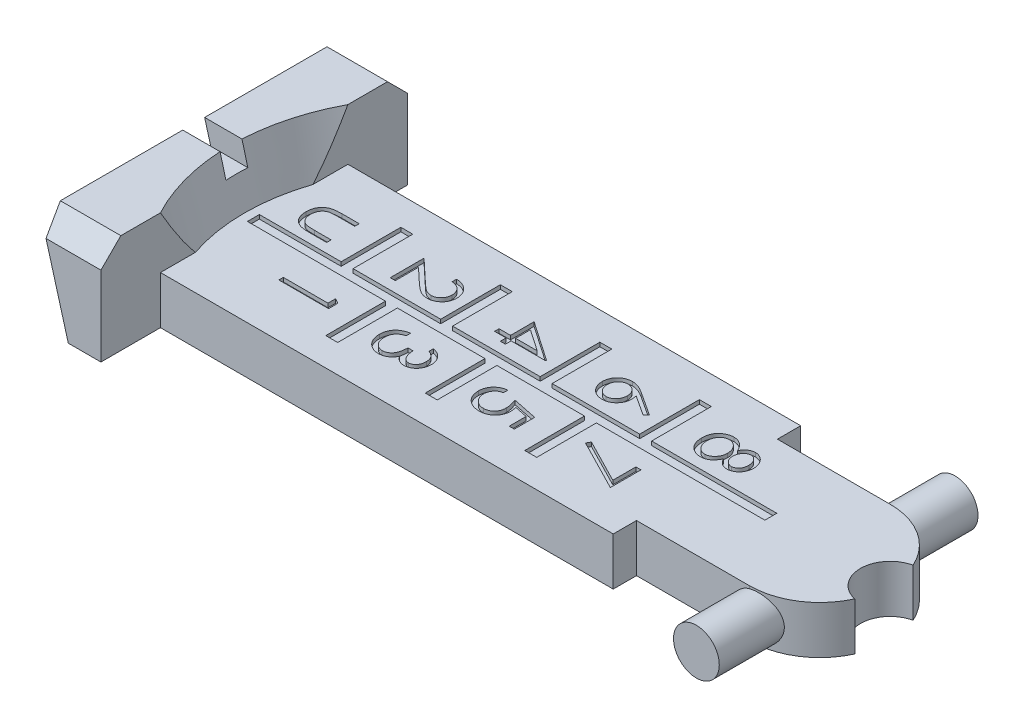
SolidWorks part; units mm, degrees
ref_plane "Front Plane" through (0, 0, 0) normal (0, 0, 1) x (1, 0, 0)
ref_plane "Top Plane" through (0, 0, 0) normal (0, 1, 0) x (1, 0, 0)
ref_plane "Right Plane" through (0, 0, 0) normal (1, 0, 0) x (0, 0, -1)
sketch "Sketch1" plane through (0, 0, 0) normal (1, 0, 0) x (0, 0, -1)
  line L0 (0, 0) -> (0, 6.35) construction
  line L1 (-9.779, 6.35) -> (9.779, 6.35)
  line L2 (-9.779, 6.35) -> (-9.779, 0)
  line L3 (-9.779, 0) -> (9.779, 0)
  line L4 (9.779, 6.35) -> (9.779, 0)
  line L6 (-0.6985, 6.35) -> (0.6985, 6.35)
  line L7 (-0.6985, 6.35) -> (-0.6985, 4.953)
  line L8 (-0.6985, 4.953) -> (0.6985, 4.953)
  line L9 (0.6985, 6.35) -> (0.6985, 4.953)
  point P4 (0, 0)
  dimension "D1" = 19.558
  dimension "D2" = 6.35
  dimension "D3" = 1.397
  dimension "D4" = 0.6985
  dimension "D5" = 1.397
extrude "Boss-Extrude1" add sketch "Sketch1" along normal blind 44.45 contours L3 L0 L8 L7 L1 L2 | L0 L3 L4 L1 L9 L8
sketch "Sketch2" plane through (0, 0, 0) normal (0, 0, 1) x (1, 0, 0)
  line L0 (0, 6.35) -> (0, 0) construction
  line L1 (44.45, 6.35) -> (3.8608, 6.35)
  line L2 (44.45, 6.35) -> (44.45, 3.048)
  line L3 (44.45, 3.048) -> (3.8608, 3.048)
  line L4 (3.8608, 6.35) -> (3.8608, 3.048)
  line L5 (44.45, 0) -> (0, 0) construction
  line L6 (1.778, 0) -> (0, 6.35)
  line L7 (1.778, 0) -> (1.778, -5.9084)
  line L8 (1.778, -5.9084) -> (-6.6677, -5.9084)
  line L9 (-6.6677, -5.9084) -> (-6.6677, 8.3398)
  line L10 (-6.6677, 8.3398) -> (0, 6.35)
  point P7 (1.778, 0)
  dimension "D1" = 3.302
  dimension "D2" = 3.8608
  dimension "D3" = 1.778
extrude "Cut-Extrude1" cut sketch "Sketch2" against normal mid plane 44.45
sketch "Sketch3" plane through (0, 0, 0) normal (0, 1, 0) x (1, 0, 0)
  line L0 (0, 0) -> (44.45, 0) construction
  line L1 (44.45, -9.779) -> (44.45, 9.779) construction
  line L2 (3.8608, 9.779) -> (3.8608, 0.6985) construction
  line L3 (3.8608, 5.9817) -> (32.7533, 5.9817)
  line L4 (3.8608, 5.9817) -> (3.8608, -5.9817)
  line L5 (3.8608, -5.9817) -> (32.7533, -5.9817)
  line L6 (32.7533, 5.9817) -> (32.7533, 4.4958)
  line L7 (32.7533, -4.4958) -> (32.7533, -5.9817)
  line L8 (32.7533, 4.4958) -> (39.9542, 4.4958)
  line L9 (3.8608, 5.9817) -> (3.8608, 13.3916)
  line L10 (32.7533, -4.4958) -> (39.9542, -4.4958)
  line L12 (3.8608, 13.3916) -> (49.8974, 13.3916)
  line L13 (49.8974, 13.3916) -> (49.8974, -14.6141)
  line L14 (49.8974, -14.6141) -> (3.8608, -14.6141)
  line L15 (3.8608, -14.6141) -> (3.8608, -5.9817)
  arc A0 (39.9542, -4.4958) -> (39.9542, 4.4958) centre (39.9542, 0) ccw
  dimension "D1" = 11.9634
  dimension "D2" = 5.9817
  dimension "D3" = 28.8925
  dimension "D4" = 8.9916
  dimension "D5" = 4.4958
extrude "Cut-Extrude2" cut sketch "Sketch3" along normal through all contours A0 L10 L7 L5 L15 L14 L13 L12 L9 L3 L6 L8
sketch "Sketch4" plane through (0, 0, 0) normal (0, 0, 1) x (1, 0, 0)
  arc A0 (41.7923, 1.5444) -> (38.8753, 1.3915) centre (40.3338, 1.4679) ccw
  arc A1 (38.8753, 1.3915) -> (41.7923, 1.5444) centre (40.3338, 1.4679) ccw
extrude "Boss-Extrude2" add sketch "Sketch4" along normal mid plane 16.51
sketch "Sketch5" plane through (0, 0, 0) normal (0, 1, 0) x (1, 0, 0)
  circle A0 centre (44.45, 0) radius 1.905
  arc A1 (39.9542, -4.4958) -> (39.9542, 4.4958) centre (39.9542, 0) ccw construction
  dimension "D1" = 3.81
extrude "Cut-Extrude3" cut sketch "Sketch5" along normal blind 16.51
chamfer "Chamfer1" distance 1.27 angle 45 2 edges at (1.9304, 6.35, -9.779) (1.9304, 6.35, 9.779)
ref_plane "Plane1" through (0, 6.35, 0) normal (0, 1, 0) x (1, 0, 0)
sketch "Sketch6" plane through (0, 6.35, 0) normal (0, 1, 0) x (1, 0, 0)
  circle A0 centre (15.0639, 0) radius 12.7
  dimension "D1" = 25.4
extrude "Cut-Extrude4" cut sketch "Sketch6" against normal up to surface (3.302 mm away)
chamfer "Chamfer3" distance 3.302 angle 15 1 edges at (2.3639, 3.048, 0)
sketch "Sketch8" plane through (0, 0, 0) normal (0, 0, 1) x (1, 0, 0)
  line L0 (4.8747, 3.048) -> (32.7533, 3.048) construction
  line L1 (3.8608, 6.35) -> (6.3658, 6.35)
  line L2 (3.8608, 6.35) -> (3.8608, 3.048)
  line L3 (3.8608, 3.048) -> (6.3658, 3.048)
  line L4 (6.3658, 6.35) -> (6.3658, 3.048)
extrude "Cut-Extrude5" cut sketch "Sketch8" against normal mid plane 16.51
ref_plane "Plane2" through (0, 3.048, 0) normal (0, 1, 0) x (1, 0, 0)
sketch "Sketch9" plane through (0, 3.048, 0) normal (0, 1, 0) x (1, 0, 0)
  line L0 (30.0971, -1.5545) -> (30.0971, -3.5083)
  line L1 (30.0971, -3.5083) -> (26.8407, -1.8394)
  line L2 (26.8407, -1.8394) -> (26.9762, -1.5933)
  line L3 (26.9762, -1.5933) -> (29.7715, -3.0262)
  line L4 (29.7715, -3.0262) -> (29.7715, -1.5545)
  line L5 (29.7715, -1.5545) -> (30.0971, -1.5545)
  line L6 (23.8055, -3.3455) -> (23.4798, -3.3455)
  line L7 (23.4798, -3.3455) -> (23.4798, -2.2656)
  line L8 (23.4798, -2.2656) -> (22.6447, -2.0945)
  line L9 (21.4446, -1.3917) -> (21.4446, -1.6766)
  line L10 (22.218, -1.7173) -> (23.8055, -2.043)
  line L11 (23.8055, -2.043) -> (23.8055, -3.3455)
  line L12 (16.7811, -1.758) -> (16.7811, -1.4731)
  line L13 (15.1936, -1.351) -> (15.1936, -1.6359)
  line L14 (15.9263, -2.2465) -> (16.2519, -2.2465)
  line L15 (11.2221, -2.0258) -> (11.2221, -2.6128)
  line L16 (11.2221, -2.6128) -> (8.0471, -2.6128)
  line L17 (8.0471, -2.6128) -> (8.0471, -2.3279)
  line L18 (8.0471, -2.3279) -> (10.8965, -2.3279)
  line L19 (10.8965, -2.3279) -> (10.8965, -1.8394)
  line L20 (10.8965, -1.8394) -> (11.2221, -2.0258)
  line L21 (27.3168, 1.7569) -> (27.1445, 1.5375)
  line L22 (27.1445, 1.5375) -> (25.8616, 2.3764)
  line L23 (25.868, 2.7046) -> (27.3168, 1.7569)
  line L24 (21.0252, 1.4892) -> (21.0252, 1.4313)
  line L25 (21.0252, 1.4313) -> (18.8271, 1.4313)
  line L26 (18.8271, 1.4313) -> (18.8271, 1.0649)
  line L27 (18.8271, 1.0649) -> (18.5015, 1.0649)
  line L28 (18.5015, 1.0649) -> (18.5015, 1.4313)
  line L29 (18.5015, 1.4313) -> (17.7688, 1.4313)
  line L30 (17.7688, 1.4313) -> (17.7688, 1.7162)
  line L31 (17.7688, 1.7162) -> (18.5015, 1.7162)
  line L32 (18.5015, 1.7162) -> (18.5015, 3.2223)
  line L33 (18.5015, 3.2223) -> (21.0252, 1.4892)
  line L34 (18.8271, 1.7162) -> (20.206, 1.7162)
  line L35 (20.206, 1.7162) -> (18.8271, 2.6626)
  line L36 (18.8271, 2.6626) -> (18.8271, 1.7162)
  line L37 (13.6752, 2.8153) -> (13.6752, 3.1002)
  line L38 (12.6505, 1.748) -> (11.8027, 2.5424)
  line L39 (11.8027, 2.5424) -> (11.8027, 1.0649)
  line L40 (11.8027, 1.0649) -> (11.4771, 1.0649)
  line L41 (11.4771, 1.0649) -> (11.4771, 3.2223)
  line L42 (11.4771, 3.2223) -> (12.7911, 1.991)
  line L43 (7.5056, 3.0595) -> (7.5056, 2.7746)
  line L44 (7.5056, 2.7746) -> (6.4295, 2.7746)
  line L45 (6.4295, 1.2685) -> (7.5056, 1.2685)
  line L46 (7.5056, 1.2685) -> (7.5056, 0.9835)
  line L47 (7.5056, 0.9835) -> (6.3761, 0.9835)
  line L48 (6.397, 3.0595) -> (7.5056, 3.0595)
  spline S0 degree 3 poles (22.6447, -2.0945) (22.6631, -2.1594) (22.6949, -2.2825) (22.7062, -2.4092) (22.7064, -2.4685) knots 0 0 0 0 0.532901 1 1 1 1
  spline S1 degree 3 poles (22.7064, -2.4685) (22.7068, -2.5381) (22.6979, -2.6411) (22.6668, -2.773) (22.635, -2.8655) (22.5943, -2.9534) (22.5434, -3.0358) (22.4839, -3.1139) (22.4156, -3.1865) (22.3403, -3.2522) (22.2595, -3.3101) (22.1737, -3.3592) (22.0823, -3.3987) (21.9862, -3.4303) (21.8479, -3.459) (21.7407, -3.468) (21.6678, -3.4676) knots 0 0 0 0 0.129394 0.190894 0.251281 0.310815 0.370371 0.430768 0.492881 0.555104 0.616067 0.677256 0.73826 0.800762 0.864778 1 1 1 1
  spline S2 degree 3 poles (21.6678, -3.4676) (21.6165, -3.4668) (21.5398, -3.4638) (21.4395, -3.448) (21.3664, -3.4323) (21.295, -3.4118) (21.2252, -3.3871) (21.1573, -3.3568) (21.0908, -3.3235) (21.0272, -3.2861) (20.9676, -3.2446) (20.9113, -3.2007) (20.8588, -3.1535) (20.8105, -3.1025) (20.7661, -3.0484) (20.7248, -2.9915) (20.6884, -2.9311) (20.6549, -2.8683) (20.6274, -2.8024) (20.6028, -2.7349) (20.5832, -2.6647) (20.5678, -2.5921) (20.5536, -2.4905) (20.5482, -2.4129) (20.5491, -2.3603) knots 0 0 0 0 0.087434 0.130118 0.172554 0.214555 0.256298 0.298438 0.340849 0.382715 0.423924 0.464246 0.504074 0.543862 0.583567 0.623094 0.663229 0.703551 0.743938 0.784541 0.82575 0.867757 0.910745 1 1 1 1
  spline S3 degree 3 poles (20.5491, -2.3603) (20.5483, -2.298) (20.5571, -2.2062) (20.5823, -2.0875) (20.6101, -2.004) (20.6449, -1.9238) (20.6889, -1.8481) (20.7388, -1.775) (20.7976, -1.7074) (20.862, -1.6447) (20.9318, -1.5885) (21.0059, -1.5385) (21.0848, -1.4954) (21.1681, -1.4587) (21.2873, -1.4195) (21.3808, -1.4002) (21.4446, -1.3917) knots 0 0 0 0 0.128708 0.190236 0.250724 0.310637 0.370766 0.431615 0.493523 0.555883 0.617342 0.678668 0.740711 0.802985 0.866803 1 1 1 1
  spline S4 degree 3 poles (21.4446, -1.6766) (21.3862, -1.6888) (21.3022, -1.7127) (21.2015, -1.7629) (21.1365, -1.8058) (21.0799, -1.8571) (21.0295, -1.9157) (20.984, -1.9813) (20.946, -2.0542) (20.9137, -2.1312) (20.8847, -2.2386) (20.8739, -2.3214) (20.8747, -2.3769) knots 0 0 0 0 0.181994 0.264377 0.34218 0.418618 0.496509 0.577369 0.661511 0.746733 0.831258 1 1 1 1
  spline S5 degree 3 poles (20.8747, -2.3769) (20.8747, -2.4304) (20.882, -2.5098) (20.9056, -2.6123) (20.9316, -2.6849) (20.9632, -2.7553) (21.0037, -2.8216) (21.0504, -2.886) (21.1039, -2.9462) (21.1629, -3.0014) (21.2259, -3.0502) (21.2931, -3.0908) (21.3634, -3.125) (21.4375, -3.151) (21.5425, -3.1762) (21.6246, -3.1823) (21.6799, -3.1827) knots 0 0 0 0 0.126425 0.18768 0.248216 0.308305 0.369661 0.431699 0.495947 0.559758 0.622295 0.683911 0.745092 0.80674 0.869087 1 1 1 1
  spline S6 degree 3 poles (21.6799, -3.1827) (21.7297, -3.1825) (21.8033, -3.1774) (21.8972, -3.1548) (21.9626, -3.1317) (22.0245, -3.1024) (22.0829, -3.0666) (22.1371, -3.0237) (22.1871, -2.9746) (22.2332, -2.9209) (22.2725, -2.8615) (22.3056, -2.7978) (22.3341, -2.7304) (22.3546, -2.6579) (22.3757, -2.5537) (22.3804, -2.4722) (22.3808, -2.4169) knots 0 0 0 0 0.127916 0.18836 0.247216 0.30563 0.36377 0.422661 0.482687 0.5433 0.604118 0.664965 0.727413 0.791468 0.858055 1 1 1 1
  spline S7 degree 3 poles (22.3808, -2.4169) (22.3807, -2.3661) (22.3751, -2.2879) (22.3582, -2.1817) (22.3405, -2.0961) (22.3172, -2.0066) (22.2791, -1.8789) (22.2435, -1.7826) (22.218, -1.7173) knots 0 0 0 0 0.211023 0.3251 0.446502 0.573788 0.708901 1 1 1 1
  spline S8 degree 3 poles (16.7811, -1.4731) (16.8441, -1.4864) (16.9344, -1.5149) (17.0493, -1.5617) (17.1274, -1.6028) (17.2007, -1.6478) (17.2675, -1.6992) (17.3296, -1.7548) (17.3847, -1.8164) (17.4345, -1.8809) (17.4771, -1.9493) (17.5136, -2.0203) (17.5438, -2.0943) (17.5664, -2.1715) (17.5888, -2.2791) (17.5956, -2.3622) (17.5952, -2.4182) knots 0 0 0 0 0.141977 0.208985 0.273957 0.336889 0.398745 0.460116 0.520825 0.580994 0.640152 0.698622 0.757271 0.816427 0.876254 1 1 1 1
  spline S9 degree 3 poles (17.5952, -2.4182) (17.5957, -2.5002) (17.5813, -2.6224) (17.5331, -2.7782) (17.4837, -2.8888) (17.4228, -2.9915) (17.3502, -3.0829) (17.2675, -3.1617) (17.1761, -3.2278) (17.0784, -3.2795) (16.9453, -3.3304) (16.8399, -3.3453) (16.7703, -3.3455) knots 0 0 0 0 0.17854 0.266093 0.354631 0.441886 0.525747 0.608114 0.690197 0.770821 0.848326 1 1 1 1
  spline S10 degree 3 poles (16.7703, -3.3455) (16.7047, -3.3454) (16.6071, -3.3355) (16.4847, -3.2953) (16.3995, -3.2545) (16.3199, -3.2015) (16.2185, -3.114) (16.155, -3.0331) (16.1171, -2.9747) knots 0 0 0 0 0.250608 0.37063 0.490072 0.610375 0.734313 1 1 1 1
  spline S11 degree 3 poles (16.1171, -2.9747) (16.0871, -3.0426) (16.0116, -3.171) (15.9049, -3.2749) (15.8462, -3.3188) knots 0 0 0 0 0.503009 1 1 1 1
  spline S12 degree 3 poles (15.8462, -3.3188) (15.8057, -3.3506) (15.7403, -3.3903) (15.6496, -3.4357) (15.5796, -3.4622) (15.5079, -3.4826) (15.4091, -3.5024) (15.3331, -3.5081) (15.282, -3.5083) knots 0 0 0 0 0.254173 0.378112 0.501712 0.623986 0.747096 1 1 1 1
  spline S13 degree 3 poles (15.282, -3.5083) (15.1932, -3.509) (15.0598, -3.4895) (14.8897, -3.4294) (14.7671, -3.3655) (14.6525, -3.2876) (14.5499, -3.195) (14.4618, -3.0886) (14.3881, -2.9699) (14.3292, -2.8413) (14.2736, -2.6555) (14.2567, -2.509) (14.2574, -2.4099) knots 0 0 0 0 0.158922 0.239619 0.322609 0.406035 0.487602 0.569685 0.653036 0.737436 0.822478 1 1 1 1
  spline S14 degree 3 poles (14.2574, -2.4099) (14.2581, -2.3432) (14.2634, -2.2443) (14.2897, -2.1173) (14.3157, -2.0279) (14.3487, -1.9428) (14.3898, -1.8622) (14.4382, -1.7856) (14.4944, -1.7137) (14.5572, -1.6466) (14.6279, -1.5861) (14.705, -1.531) (14.7894, -1.483) (14.8802, -1.4398) (15.0143, -1.3911) (15.1203, -1.3638) (15.1936, -1.351) knots 0 0 0 0 0.128963 0.190377 0.250092 0.308548 0.366398 0.424542 0.48317 0.542243 0.601739 0.662506 0.724856 0.789128 0.856346 1 1 1 1
  spline S15 degree 3 poles (15.1936, -1.6359) (15.1461, -1.6502) (15.0765, -1.6719) (14.9904, -1.7104) (14.9329, -1.7404) (14.8801, -1.772) (14.819, -1.8179) (14.7777, -1.8561) (14.7548, -1.8846) knots 0 0 0 0 0.291316 0.425966 0.55216 0.671527 0.786122 1 1 1 1
  spline S16 degree 3 poles (14.7548, -1.8846) (14.7265, -1.9194) (14.6887, -1.9755) (14.6485, -2.0566) (14.6254, -2.1217) (14.6058, -2.1898) (14.5883, -2.2877) (14.5825, -2.3635) (14.583, -2.415) knots 0 0 0 0 0.236178 0.355663 0.475904 0.600127 0.728608 1 1 1 1
  spline S17 degree 3 poles (14.583, -2.415) (14.5827, -2.4732) (14.5893, -2.5584) (14.6094, -2.6683) (14.632, -2.7439) (14.6599, -2.8155) (14.6949, -2.8821) (14.7361, -2.9445) (14.7828, -3.0019) (14.834, -3.0536) (14.8875, -3.0991) (14.9432, -3.1377) (15.0013, -3.1689) (15.0616, -3.1935) (15.1456, -3.2162) (15.2108, -3.2243) (15.2547, -3.2234) knots 0 0 0 0 0.148752 0.218403 0.28576 0.350598 0.414964 0.478069 0.541761 0.60435 0.664075 0.721464 0.777587 0.832644 0.887844 1 1 1 1
  spline S18 degree 3 poles (15.2547, -3.2234) (15.3136, -3.2231) (15.4027, -3.2097) (15.5138, -3.1633) (15.5928, -3.1147) (15.6661, -3.0554) (15.7315, -2.9861) (15.7854, -2.9062) (15.8227, -2.8327) (15.8481, -2.7676) (15.8651, -2.7119) (15.8794, -2.6496) (15.8928, -2.5813) (15.9041, -2.5066) (15.9172, -2.3945) (15.9232, -2.307) (15.9263, -2.2465) knots 0 0 0 0 0.133485 0.201035 0.271234 0.34288 0.413836 0.485977 0.56023 0.599884 0.644055 0.691892 0.744688 0.801492 0.862858 1 1 1 1
  spline S19 degree 3 poles (16.2519, -2.2465) (16.2507, -2.3235) (16.2617, -2.4366) (16.2916, -2.5826) (16.325, -2.6827) (16.3639, -2.774) (16.4091, -2.8533) (16.4594, -2.9193) (16.5155, -2.9718) (16.5756, -3.0112) (16.6589, -3.0498) (16.7268, -3.0602) (16.7716, -3.0606) knots 0 0 0 0 0.215787 0.318027 0.417574 0.51165 0.596162 0.672935 0.74367 0.810677 0.874059 1 1 1 1
  spline S20 degree 3 poles (16.7716, -3.0606) (16.8046, -3.0613) (16.8535, -3.055) (16.916, -3.0358) (16.9611, -3.0164) (17.0042, -2.9903) (17.0456, -2.9591) (17.0852, -2.9219) (17.1221, -2.8793) (17.1573, -2.8336) (17.1871, -2.7835) (17.2126, -2.7305) (17.2337, -2.6746) (17.2495, -2.6155) (17.265, -2.5315) (17.2693, -2.4663) (17.2696, -2.422) knots 0 0 0 0 0.109966 0.163247 0.218076 0.273301 0.330909 0.390995 0.454176 0.518862 0.583311 0.648517 0.715031 0.782502 0.852323 1 1 1 1
  spline S21 degree 3 poles (17.2696, -2.422) (17.2697, -2.3515) (17.2569, -2.2475) (17.2098, -2.1188) (17.1687, -2.0465) (17.1281, -1.9931) (17.0926, -1.9549) (17.0532, -1.9174) (17.0075, -1.8831) (16.9584, -1.8484) (16.8832, -1.805) (16.8232, -1.7759) (16.7811, -1.758) knots 0 0 0 0 0.239685 0.351816 0.463766 0.520818 0.579448 0.640604 0.705298 0.773634 0.844669 1 1 1 1
  spline S22 degree 3 poles (32.1209, 1.6787) (32.0948, 1.6279) (32.0548, 1.5541) (31.9935, 1.4639) (31.9485, 1.4023) (31.9015, 1.3462) (31.8525, 1.2961) (31.8026, 1.251) (31.751, 1.2116) (31.6979, 1.1769) (31.643, 1.147) (31.5865, 1.1214) (31.5279, 1.1011) (31.4679, 1.0844) (31.3842, 1.0689) (31.32, 1.0657) (31.2769, 1.0649) knots 0 0 0 0 0.1551 0.22722 0.295911 0.362056 0.42552 0.485813 0.544495 0.60146 0.657841 0.713974 0.769468 0.82613 0.882885 1 1 1 1
  spline S23 degree 3 poles (31.2769, 1.0649) (31.2163, 1.0647) (31.1264, 1.0727) (31.0098, 1.0972) (30.9256, 1.1235) (30.8445, 1.1578) (30.7393, 1.2143) (30.665, 1.2654) (30.6192, 1.3054) knots 0 0 0 0 0.253673 0.377325 0.499385 0.622918 0.745839 1 1 1 1
  spline S24 degree 3 poles (30.6192, 1.3054) (30.5628, 1.3539) (30.4848, 1.435) (30.4045, 1.5612) (30.3554, 1.6635) (30.3173, 1.7736) (30.2797, 1.9348) (30.2716, 2.0618) (30.2707, 2.1481) knots 0 0 0 0 0.237093 0.354796 0.474576 0.59746 0.724926 1 1 1 1
  spline S25 degree 3 poles (30.2707, 2.1481) (30.2716, 2.2309) (30.2785, 2.3527) (30.3117, 2.5071) (30.3448, 2.6122) (30.3878, 2.709) (30.4413, 2.7975) (30.5032, 2.8787) (30.5752, 2.9503) (30.6524, 3.0139) (30.732, 3.0698) (30.8141, 3.1162) (30.8973, 3.1555) (30.983, 3.1856) (31.1002, 3.2136) (31.1904, 3.2222) (31.2508, 3.2223) knots 0 0 0 0 0.152863 0.22356 0.290375 0.355403 0.418291 0.480389 0.543073 0.604924 0.664398 0.721943 0.778375 0.83383 0.888861 1 1 1 1
  spline S26 degree 3 poles (31.2508, 3.2223) (31.2948, 3.2221) (31.3602, 3.2176) (31.4455, 3.202) (31.5073, 3.1864) (31.5671, 3.1652) (31.6253, 3.1396) (31.6819, 3.1097) (31.7372, 3.0751) (31.7905, 3.0349) (31.8425, 2.9894) (31.8926, 2.9377) (31.9414, 2.8803) (31.9896, 2.8179) (32.0514, 2.7237) (32.0949, 2.6489) (32.1209, 2.5958) knots 0 0 0 0 0.116315 0.172675 0.22878 0.28458 0.340257 0.39663 0.453507 0.512318 0.572648 0.636022 0.702363 0.771483 0.844184 1 1 1 1
  spline S27 degree 3 poles (32.1209, 2.5958) (32.1574, 2.6683) (32.2221, 2.7681) (32.3287, 2.8794) (32.4136, 2.945) (32.5034, 2.9965) (32.6287, 3.044) (32.7275, 3.0607) (32.7938, 3.0595) knots 0 0 0 0 0.282426 0.41085 0.535029 0.654701 0.770133 1 1 1 1
  spline S28 degree 3 poles (32.7938, 3.0595) (32.8618, 3.0595) (32.9653, 3.0436) (33.0963, 2.9916) (33.1934, 2.9382) (33.285, 2.8716) (33.3672, 2.7917) (33.4391, 2.7005) (33.4995, 2.5983) (33.5486, 2.4883) (33.5945, 2.3324) (33.609, 2.2108) (33.6085, 2.129) knots 0 0 0 0 0.14887 0.226668 0.307735 0.391157 0.473929 0.557928 0.644989 0.733364 0.821092 1 1 1 1
  spline S29 degree 3 poles (33.6085, 2.129) (33.6084, 2.0495) (33.5956, 1.9305) (33.5469, 1.78) (33.4981, 1.6735) (33.4379, 1.5743) (33.3649, 1.4867) (33.2832, 1.4093) (33.1916, 1.3452) (33.0948, 1.2926) (32.9605, 1.2435) (32.855, 1.2277) (32.7849, 1.2278) knots 0 0 0 0 0.176306 0.262626 0.349446 0.435498 0.518928 0.601355 0.684256 0.765807 0.844877 1 1 1 1
  spline S30 degree 3 poles (32.7849, 1.2278) (32.7174, 1.2279) (32.6163, 1.2403) (32.4918, 1.2894) (32.4046, 1.3387) (32.3243, 1.4032) (32.2213, 1.5115) (32.1582, 1.6087) (32.1209, 1.6787) knots 0 0 0 0 0.239413 0.35541 0.472091 0.592859 0.718703 1 1 1 1
  spline S31 degree 3 poles (33.2829, 2.1449) (33.282, 2.1884) (33.2793, 2.2527) (33.2633, 2.3354) (33.2477, 2.3936) (33.2266, 2.4486) (33.2017, 2.501) (33.1715, 2.5499) (33.1376, 2.596) (33.1003, 2.6375) (33.0615, 2.6744) (33.0203, 2.705) (32.9779, 2.731) (32.9328, 2.7498) (32.8708, 2.7689) (32.8221, 2.7753) (32.7893, 2.7746) knots 0 0 0 0 0.147209 0.216447 0.284025 0.350655 0.415031 0.47963 0.544652 0.608044 0.667828 0.725114 0.780992 0.835527 0.889438 1 1 1 1
  spline S32 degree 3 poles (32.7893, 2.7746) (32.7565, 2.7746) (32.7075, 2.768) (32.644, 2.7489) (32.5984, 2.7266) (32.5532, 2.6998) (32.5096, 2.6667) (32.4672, 2.6272) (32.4267, 2.5828) (32.3886, 2.5343) (32.3556, 2.483) (32.328, 2.4294) (32.3051, 2.3742) (32.2872, 2.3167) (32.2701, 2.2367) (32.2652, 2.175) (32.2652, 2.1334) knots 0 0 0 0 0.107826 0.161924 0.21751 0.274498 0.334815 0.397555 0.464755 0.532901 0.600097 0.665354 0.731084 0.796883 0.863292 1 1 1 1
  spline S33 degree 3 poles (32.2652, 2.1334) (32.2649, 2.0797) (32.2743, 1.9994) (32.3053, 1.8966) (32.3368, 1.8226) (32.3764, 1.7536) (32.4238, 1.692) (32.4779, 1.6385) (32.5379, 1.5936) (32.6017, 1.5588) (32.6855, 1.5231) (32.7522, 1.5129) (32.7957, 1.5127) knots 0 0 0 0 0.178494 0.266838 0.356558 0.445334 0.530806 0.614076 0.697707 0.779142 0.855354 1 1 1 1
  spline S34 degree 3 poles (32.7957, 1.5127) (32.8256, 1.5127) (32.8705, 1.5176) (32.9281, 1.5351) (32.9707, 1.5527) (33.012, 1.576) (33.0527, 1.6035) (33.0919, 1.637) (33.1305, 1.6745) (33.1662, 1.7171) (33.1977, 1.7646) (33.2243, 1.8169) (33.246, 1.8738) (33.2623, 1.9353) (33.2791, 2.0256) (33.2824, 2.0965) (33.2829, 2.1449) knots 0 0 0 0 0.101034 0.151084 0.203062 0.256248 0.310847 0.368769 0.430015 0.49252 0.556049 0.621996 0.690192 0.761385 0.836356 1 1 1 1
  spline S35 degree 3 poles (31.9396, 2.1265) (31.9403, 2.1819) (31.9327, 2.2635) (31.9118, 2.3691) (31.8887, 2.4435) (31.8586, 2.5142) (31.8224, 2.5819) (31.7796, 2.6458) (31.7307, 2.7051) (31.678, 2.7593) (31.6223, 2.8068) (31.5645, 2.8472) (31.5039, 2.8797) (31.4418, 2.9063) (31.3544, 2.93) (31.2868, 2.9373) (31.2412, 2.9374) knots 0 0 0 0 0.139812 0.206497 0.271535 0.336082 0.400528 0.464984 0.53005 0.594423 0.655583 0.714849 0.772115 0.828999 0.885122 1 1 1 1
  spline S36 degree 3 poles (31.2412, 2.9374) (31.1847, 2.9373) (31.0992, 2.9247) (30.9916, 2.8829) (30.914, 2.8394) (30.8415, 2.7855) (30.7783, 2.7191) (30.7221, 2.6445) (30.6767, 2.5591) (30.6404, 2.4659) (30.6061, 2.3278) (30.5957, 2.2192) (30.5963, 2.1449) knots 0 0 0 0 0.148596 0.224471 0.302323 0.381919 0.461149 0.542417 0.626716 0.714597 0.804903 1 1 1 1
  spline S37 degree 3 poles (30.5963, 2.1449) (30.5963, 2.087) (30.602, 2.0021) (30.6234, 1.8932) (30.646, 1.8184) (30.6736, 1.7477) (30.7092, 1.6823) (30.7496, 1.6204) (30.7975, 1.5652) (30.8488, 1.5149) (30.903, 1.4711) (30.9588, 1.433) (31.0173, 1.4031) (31.0775, 1.3793) (31.1615, 1.356) (31.2272, 1.3496) (31.2711, 1.3499) knots 0 0 0 0 0.149161 0.218827 0.285567 0.350313 0.414125 0.477179 0.540368 0.602202 0.662034 0.719934 0.775907 0.831115 0.886667 1 1 1 1
  spline S38 degree 3 poles (31.2711, 1.3499) (31.3138, 1.3506) (31.378, 1.3564) (31.4599, 1.3807) (31.5197, 1.4055) (31.5768, 1.4385) (31.6328, 1.4773) (31.6861, 1.5242) (31.7371, 1.5772) (31.7843, 1.635) (31.826, 1.6963) (31.8612, 1.7609) (31.8898, 1.8285) (31.9123, 1.8989) (31.9336, 1.9979) (31.9397, 2.0747) (31.9396, 2.1265) knots 0 0 0 0 0.113063 0.169181 0.225775 0.283826 0.343454 0.405907 0.471392 0.538003 0.603064 0.667602 0.732225 0.797005 0.863048 1 1 1 1
  spline S39 degree 2 poles (25.8616, 2.3764) (25.8914, 2.2133) (25.8922, 2.0476) knots 0 0 0 1 1 1
  spline S40 degree 3 poles (25.8922, 2.0476) (25.892, 1.9841) (25.8839, 1.89) (25.8557, 1.7689) (25.8256, 1.6833) (25.787, 1.6014) (25.7408, 1.5228) (25.6845, 1.4488) (25.6217, 1.3787) (25.5521, 1.315) (25.4783, 1.2586) (25.4003, 1.2112) (25.3181, 1.1727) (25.232, 1.1429) (25.1103, 1.1134) (25.0154, 1.1061) (24.9515, 1.1056) knots 0 0 0 0 0.128405 0.190067 0.250943 0.311546 0.372863 0.435024 0.499072 0.563091 0.62551 0.68668 0.747283 0.808563 0.870742 1 1 1 1
  spline S41 degree 3 poles (24.9515, 1.1056) (24.8641, 1.1048) (24.7346, 1.1208) (24.571, 1.1742) (24.4576, 1.2303) (24.3524, 1.3002) (24.2591, 1.3853) (24.176, 1.4828) (24.1064, 1.593) (24.0497, 1.7116) (23.9948, 1.8785) (23.9792, 2.0101) (23.979, 2.0978) knots 0 0 0 0 0.169125 0.250399 0.33229 0.413364 0.494172 0.576022 0.660757 0.745783 0.830044 1 1 1 1
  spline S42 degree 3 poles (23.979, 2.0978) (23.9787, 2.1824) (23.9939, 2.3091) (24.0473, 2.4693) (24.1019, 2.5832) (24.1709, 2.6887) (24.2539, 2.7831) (24.3493, 2.8659) (24.4569, 2.9349) (24.5726, 2.9895) (24.7337, 3.0445) (24.8611, 3.0586) (24.9458, 3.0595) knots 0 0 0 0 0.167052 0.249566 0.33274 0.415915 0.497828 0.580373 0.6646 0.749467 0.83251 1 1 1 1
  spline S43 degree 3 poles (24.9458, 3.0595) (25.0125, 3.0591) (25.1145, 3.0487) (25.2498, 3.0164) (25.3376, 2.9889) (25.4095, 2.9599) (25.4674, 2.9357) (25.5271, 2.9056) (25.5905, 2.8735) (25.656, 2.8365) (25.7499, 2.7815) (25.8199, 2.7358) (25.868, 2.7046) knots 0 0 0 0 0.199726 0.305276 0.415811 0.474472 0.537274 0.603657 0.674299 0.749834 0.828598 1 1 1 1
  spline S44 degree 3 poles (25.5665, 2.1074) (25.5656, 2.1545) (25.5619, 2.2245) (25.5413, 2.3137) (25.5222, 2.3765) (25.4958, 2.4352) (25.4637, 2.4903) (25.4259, 2.5421) (25.383, 2.59) (25.336, 2.6333) (25.2857, 2.6707) (25.2333, 2.7029) (25.1783, 2.7291) (25.1207, 2.7495) (25.0398, 2.7695) (24.9766, 2.7738) (24.9343, 2.7746) knots 0 0 0 0 0.137901 0.203196 0.26679 0.329106 0.390654 0.452653 0.515748 0.577926 0.63893 0.698351 0.757296 0.816394 0.876267 1 1 1 1
  spline S45 degree 3 poles (24.9343, 2.7746) (24.8922, 2.7748) (24.8296, 2.7683) (24.7491, 2.7473) (24.6921, 2.7243) (24.6369, 2.6969) (24.5854, 2.6607) (24.5346, 2.6206) (24.4883, 2.5726) (24.4453, 2.5212) (24.4077, 2.4662) (24.3755, 2.4089) (24.3502, 2.3485) (24.3295, 2.2859) (24.3098, 2.1975) (24.3054, 2.1287) (24.3047, 2.0826) knots 0 0 0 0 0.121262 0.180746 0.239231 0.298308 0.358183 0.420359 0.484792 0.549938 0.613718 0.676681 0.739154 0.8022 0.86674 1 1 1 1
  spline S46 degree 3 poles (24.3047, 2.0826) (24.3054, 2.0364) (24.3098, 1.9677) (24.3295, 1.8792) (24.3502, 1.8166) (24.3755, 1.7562) (24.4075, 1.699) (24.4455, 1.6445) (24.4883, 1.5931) (24.5349, 1.5453) (24.585, 1.5042) (24.6373, 1.4691) (24.6919, 1.4406) (24.7492, 1.4179) (24.8296, 1.3968) (24.8922, 1.3904) (24.9343, 1.3906) knots 0 0 0 0 0.133283 0.197835 0.260892 0.323377 0.38635 0.449638 0.514795 0.57924 0.641814 0.701359 0.760727 0.819222 0.878716 1 1 1 1
  spline S47 degree 3 poles (24.9343, 1.3906) (24.9769, 1.3898) (25.0398, 1.3976) (25.121, 1.4185) (25.1787, 1.4417) (25.2336, 1.4719) (25.286, 1.5086) (25.3363, 1.5511) (25.3831, 1.6001) (25.4259, 1.6536) (25.4636, 1.7104) (25.4955, 1.7698) (25.5221, 1.8318) (25.5413, 1.897) (25.5618, 1.9884) (25.5656, 2.0596) (25.5665, 2.1074) knots 0 0 0 0 0.119994 0.178225 0.236256 0.294929 0.354716 0.41673 0.480664 0.545832 0.609758 0.672971 0.736017 0.799839 0.864775 1 1 1 1
  spline S48 degree 3 poles (13.6752, 3.1002) (13.7495, 3.0984) (13.8586, 3.0865) (13.9989, 3.0531) (14.0968, 3.0186) (14.1899, 2.9757) (14.2779, 2.9242) (14.3604, 2.8633) (14.4367, 2.7942) (14.5068, 2.7191) (14.5672, 2.6381) (14.6183, 2.5529) (14.661, 2.4639) (14.6931, 2.3701) (14.7254, 2.2377) (14.7336, 2.1344) (14.7335, 2.0648) knots 0 0 0 0 0.135103 0.198979 0.261904 0.323495 0.385195 0.446969 0.509765 0.572251 0.633405 0.693251 0.752583 0.812579 0.873275 1 1 1 1
  spline S49 degree 3 poles (14.7335, 2.0648) (14.7336, 1.9964) (14.7252, 1.8957) (14.6958, 1.7666) (14.6656, 1.6766) (14.6249, 1.5922) (14.5761, 1.5129) (14.5197, 1.4377) (14.4533, 1.37) (14.3823, 1.3079) (14.3066, 1.2543) (14.2284, 1.2084) (14.147, 1.1701) (14.0619, 1.1419) (13.9436, 1.113) (13.8513, 1.1064) (13.7897, 1.1056) knots 0 0 0 0 0.136517 0.200789 0.26383 0.325735 0.387291 0.449509 0.512968 0.576275 0.63758 0.697903 0.757172 0.816599 0.876653 1 1 1 1
  spline S50 degree 3 poles (13.7897, 1.1056) (13.702, 1.1053) (13.571, 1.1223) (13.4041, 1.177) (13.3037, 1.2259) (13.2227, 1.2754) (13.1561, 1.3199) (13.0843, 1.372) (13.0077, 1.4325) (12.9256, 1.5001) (12.8043, 1.6045) (12.7134, 1.6894) (12.6505, 1.748) knots 0 0 0 0 0.195672 0.292422 0.391343 0.444462 0.504229 0.570352 0.642546 0.722288 0.807921 1 1 1 1
  spline S51 degree 3 poles (12.7911, 1.991) (12.8511, 1.9333) (12.938, 1.8509) (13.0517, 1.7488) (13.1266, 1.6835) (13.1961, 1.6274) (13.258, 1.5776) (13.3149, 1.5377) (13.3809, 1.4944) (13.4615, 1.4526) (13.5923, 1.4044) (13.6958, 1.3905) (13.7642, 1.3906) knots 0 0 0 0 0.212829 0.306101 0.390647 0.466924 0.534481 0.593587 0.644557 0.7362 0.825024 1 1 1 1
  spline S52 degree 3 poles (13.7642, 1.3906) (13.8069, 1.3904) (13.8702, 1.3969) (13.9516, 1.4175) (14.0099, 1.4392) (14.0657, 1.4679) (14.1188, 1.5028) (14.1703, 1.543) (14.2185, 1.5896) (14.2626, 1.6408) (14.3018, 1.6949) (14.3345, 1.7521) (14.3613, 1.8121) (14.3823, 1.875) (14.4021, 1.9639) (14.4077, 2.0327) (14.4079, 2.0794) knots 0 0 0 0 0.122122 0.180988 0.239933 0.299906 0.359989 0.421776 0.486576 0.551535 0.615018 0.677259 0.73973 0.80305 0.866495 1 1 1 1
  spline S53 degree 3 poles (14.4079, 2.0794) (14.4074, 2.1281) (14.4026, 2.2003) (14.3816, 2.2929) (14.3606, 2.358) (14.3339, 2.4202) (14.3006, 2.479) (14.2609, 2.5344) (14.2159, 2.5865) (14.1657, 2.6344) (14.1099, 2.6766) (14.0492, 2.7134) (13.984, 2.7455) (13.9137, 2.7716) (13.811, 2.7989) (13.7304, 2.8113) (13.6752, 2.8153) knots 0 0 0 0 0.126547 0.186887 0.245878 0.304041 0.362191 0.420976 0.48066 0.5406 0.600689 0.661936 0.724443 0.789038 0.856314 1 1 1 1
  spline S54 degree 3 poles (6.4295, 2.7746) (6.3691, 2.7743) (6.2821, 2.7741) (6.1712, 2.7686) (6.0995, 2.7637) (6.0355, 2.7573) (5.9651, 2.748) (5.9163, 2.7385) (5.887, 2.7294) knots 0 0 0 0 0.33212 0.477936 0.609932 0.727032 0.831671 1 1 1 1
  spline S55 degree 3 poles (5.887, 2.7294) (5.8528, 2.7175) (5.802, 2.6985) (5.7405, 2.6619) (5.6967, 2.6321) (5.6561, 2.5977) (5.6187, 2.5592) (5.5831, 2.5178) (5.541, 2.4563) (5.496, 2.3723) (5.4426, 2.2217) (5.4298, 2.0995) (5.4297, 2.0171) knots 0 0 0 0 0.119716 0.178086 0.235971 0.29461 0.353536 0.413161 0.474545 0.599234 0.727029 1 1 1 1
  spline S56 degree 3 poles (5.4297, 2.0171) (5.4301, 1.935) (5.4421, 1.8143) (5.4939, 1.6658) (5.5463, 1.5689) (5.6105, 1.4837) (5.7104, 1.3889) (5.8, 1.3377) (5.8641, 1.3155) knots 0 0 0 0 0.279837 0.408371 0.533043 0.653596 0.770016 1 1 1 1
  spline S57 degree 3 poles (5.8641, 1.3155) (5.8918, 1.3063) (5.9391, 1.2961) (6.0089, 1.2862) (6.0751, 1.2792) (6.1506, 1.2742) (6.2698, 1.2704) (6.3637, 1.2677) (6.4295, 1.2685) knots 0 0 0 0 0.154074 0.254591 0.371465 0.504755 0.653494 1 1 1 1
  spline S58 degree 3 poles (6.3761, 0.9835) (6.3016, 0.9839) (6.1933, 0.9864) (6.0542, 0.9983) (5.9606, 1.0113) (5.8745, 1.0266) (5.7956, 1.0463) (5.7243, 1.0699) (5.6592, 1.0965) (5.6002, 1.1279) (5.5442, 1.1613) (5.4926, 1.1999) (5.4428, 1.2405) (5.3973, 1.2857) (5.3551, 1.3345) (5.3155, 1.3865) (5.28, 1.4426) (5.2481, 1.502) (5.2197, 1.565) (5.1973, 1.6321) (5.178, 1.7025) (5.1629, 1.7767) (5.1482, 1.8826) (5.1445, 1.9642) (5.1447, 2.0196) knots 0 0 0 0 0.120696 0.175548 0.226191 0.273711 0.317302 0.357837 0.395428 0.431089 0.466097 0.501015 0.535424 0.570174 0.604765 0.640093 0.675939 0.712225 0.749455 0.787601 0.826784 0.867829 0.91016 1 1 1 1
  spline S59 degree 3 poles (5.1447, 2.0196) (5.1446, 2.075) (5.1482, 2.1566) (5.1628, 2.2626) (5.1781, 2.3369) (5.1972, 2.4076) (5.2199, 2.475) (5.2481, 2.5384) (5.2798, 2.5984) (5.3157, 2.6547) (5.355, 2.7074) (5.3978, 2.7565) (5.4437, 2.802) (5.4934, 2.8433) (5.5466, 2.8809) (5.6025, 2.9153) (5.6624, 2.9465) (5.7283, 2.9732) (5.8011, 2.9969) (5.8818, 3.0162) (5.9702, 3.0319) (6.0659, 3.0446) (6.2089, 3.0568) (6.3203, 3.059) (6.397, 3.0595) knots 0 0 0 0 0.088727 0.130534 0.171071 0.210096 0.247769 0.284849 0.320986 0.356387 0.391549 0.426191 0.460511 0.494971 0.529534 0.564576 0.600096 0.637535 0.678213 0.722583 0.770182 0.821879 0.877067 1 1 1 1
extrude "Cut-Extrude6" cut sketch "Sketch9" against normal blind 0.254
sketch "Sketch10" plane through (0, 3.048, 0) normal (0, 1, 0) x (1, 0, 0)
  line L0 (0, 0) -> (42.545, 0) construction
  line L1 (22.4916, 0.381) -> (28.0796, 0.381)
  line L2 (3.81, 0.381) -> (9.0296, 0.381)
  line L3 (3.81, 0.381) -> (3.81, -0.381)
  line L4 (3.81, -0.381) -> (12.6191, -0.381)
  line L5 (36.83, 0.381) -> (36.83, -0.381)
  line L6 (16.1416, 0.381) -> (21.7296, 0.381)
  line L7 (9.0296, 0.381) -> (9.0296, 4.191)
  line L8 (9.0296, 4.191) -> (9.7916, 4.191)
  line L9 (9.7916, 0.381) -> (9.7916, 4.191)
  line L10 (15.3796, 0.381) -> (15.3796, 4.191)
  line L11 (15.3796, 4.191) -> (16.1416, 4.191)
  line L12 (16.1416, 0.381) -> (16.1416, 4.191)
  line L13 (28.8416, 0.381) -> (36.83, 0.381)
  line L14 (21.7296, 0.381) -> (21.7296, 4.191)
  line L15 (21.7296, 4.191) -> (22.4916, 4.191)
  line L16 (22.4916, 0.381) -> (22.4916, 4.191)
  line L17 (11.2221, -2.6128) -> (11.2221, -2.0258) construction
  line L18 (28.0796, 0.381) -> (28.0796, 4.191)
  line L19 (28.0796, 4.191) -> (28.8416, 4.191)
  line L20 (28.8416, 0.381) -> (28.8416, 4.191)
  line L21 (9.7916, 0.381) -> (15.3796, 0.381)
  line L22 (18.9691, -0.381) -> (18.9691, -4.191)
  line L23 (12.6191, -0.381) -> (12.6191, -4.191)
  line L24 (12.6191, -4.191) -> (13.3811, -4.191)
  line L25 (13.3811, -0.381) -> (13.3811, -4.191)
  line L26 (13.3811, -0.381) -> (18.9691, -0.381)
  line L27 (19.7311, -0.381) -> (19.7311, -4.191)
  line L28 (18.9691, -4.191) -> (19.7311, -4.191)
  line L29 (25.3191, -0.381) -> (25.3191, -4.191)
  line L30 (26.0811, -0.381) -> (26.0811, -4.191)
  line L31 (25.3191, -4.191) -> (26.0811, -4.191)
  line L32 (19.7311, -0.381) -> (25.3191, -0.381)
  line L33 (26.0811, -0.381) -> (36.83, -0.381)
  arc A0 (44.0464, 1.8618) -> (44.0464, -1.8618) centre (44.45, 0) ccw construction
  point P31 (11.2221, -2.3193)
  dimension "D1" = 0.762
  dimension "D2" = 0.381
  dimension "D3" = 3.81
  dimension "D4" = 33.02
  dimension "D5" = 0.762
  dimension "D6" = 1.524
  dimension "D7" = 3.81
  dimension "D9" = 3.81
  dimension "D10" = 1.397
  dimension "D11" = 0.762
  dimension "D8" = 4
  dimension "D12" = 3
extrude "Cut-Extrude7" cut sketch "Sketch10" against normal blind 0.254
